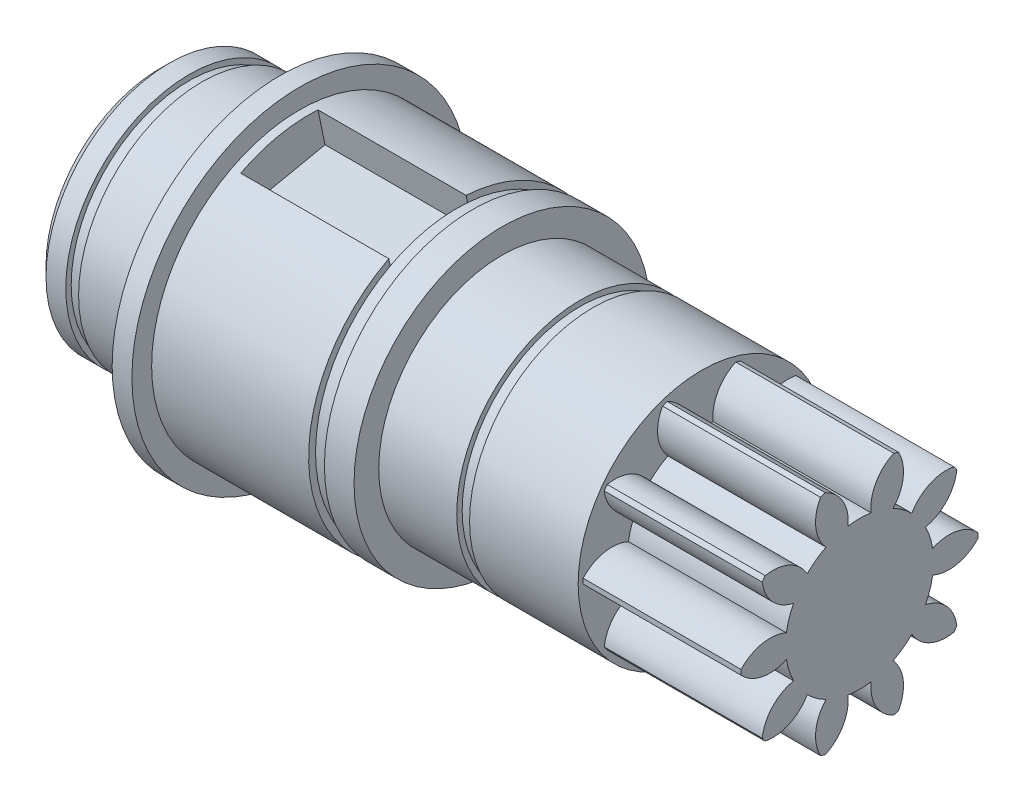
SolidWorks part; units mm, degrees
ref_plane "Plane1" through (0, 0, 0) normal (0, 0, 1) x (1, 0, 0)
ref_plane "Plane2" through (0, 0, 0) normal (0, 1, 0) x (1, 0, 0)
ref_plane "Plane3" through (0, 0, 0) normal (1, 0, 0) x (0, 0, -1)
sketch "HoldingSke" plane through (0, 0, 0) normal (0, 1, 0) x (1, 0, 0)
  line L0 (0, 0) -> (0.4924, -0.0868)
  line L1 (-15, 0) -> (100, 0) construction
  line L2 (0, 0) -> (-2.1039, 2.3779)
  line L3 (0, 0) -> (-11.863, 4.5341)
  line L4 (0, 0) -> (8.5048, 1.4996)
  line L5 (0, 0) -> (-46.8476, -17.4728)
  line L6 (0, 0) -> (-13.2634, -8.9489)
  line L7 (-2.1039, 2.3779) -> (8.6586, 51.2059)
  line L8 (-76.2, 54.61) -> (-73.9, 54.61)
  line L9 (-71.009, 38.7566) -> (-53.1078, 45.2721)
  line L10 (-76.2, 71.12) -> (104.1128, 71.12)
  line L11 (0, 0) -> (-16, 0)
  line L12 (-76.2, 101.6) -> (-76.133, 101.6)
  line L13 (24.9733, 27.94) -> (52.9518, 28.4284)
  line L14 (24.9733, 27.94) -> (24.9743, 27.94)
  line L15 (24.9733, 27.94) -> (100.4006, 29.5858)
  line L16 (-63.627, -2) -> (-12.827, -2)
  circle A0 centre (0, 0) radius 8
  circle A1 centre (0, 0) radius 7.499
  circle A2 centre (0, 0) radius 37.5
  circle A3 centre (0, 0) radius 7.4736
  dimension "MHD" = 14.998
  dimension "Hub_dia" = 75
  dimension "Bore" = 16
  dimension "MBD" = 14.9472
  dimension "Num_teeth" = 10
  dimension "Pitch_radius" = 180.3128
  dimension "Pitch" = 0.5
  dimension "Width" = 16
  dimension "Overall_len" = 50
  dimension "Show_teeth" = 10
  dimension "Thickness" = 16
  dimension "OAL" = 50.0001
  dimension "T_dim" = 2.3
  dimension "Ap" = 20
  dimension "H" = 19.05
  dimension "Backlash" = 0.067
  dimension "Addendum_fac" = 1
  dimension "Dedendum_fac" = 1.25
  dimension "Clearance_fac" = 0.25
  dimension "Dedendum_add" = 0.001
  dimension "Module" = 2
sketch "BasProSke" plane through (0, 0, 0) normal (0, 1, 0) x (1, 0, 0)
  line L0 (-10, 0) -> (60, 0) construction
  line L1 (0, 0) -> (0, 12)
  line L2 (0, 0) -> (16, 0)
  line L3 (16, 0) -> (16, 12)
  line L4 (16, 12) -> (0, 12)
  dimension "Diameter" = 24
  dimension "Thickness" = 16
revolve "Base-Revolve" add sketch "BasProSke" angle 360 about L0
sketch "TooCutSke" plane through (0, 0, 0) normal (1, 0, 0) x (0, 0, -1)
  line L1 (0, 0) -> (0, 107) construction
  line L2 (0, 0) -> (-1.6814, 9.8576) construction
  line L3 (0, 0) -> (-6.1153, 18.8209) construction
  line L4 (-1.6814, 9.8576) -> (-3.0576, 9.4105) construction
  arc A0 (1.1737, 7.4066) -> (-1.1737, 7.4066) centre (0, 0) ccw
  arc A1 (3.4979, 11.5054) -> (-3.4979, 11.5054) centre (0, 0) ccw
  circle A2 centre (0, 0) radius 10 construction
  circle A3 centre (0, 0) radius 9.3969 construction
  arc A4 (-1.1737, 7.4066) -> (-3.4979, 11.5054) centre (-5.1477, 7.8615) ccw
  arc A5 (3.4979, 11.5054) -> (1.1737, 7.4066) centre (5.1477, 7.8615) ccw
  dimension "Root_dia" = 14.998
  dimension "Overcut_dia" = 24.0508
  dimension "Pitch_dia" = 20
  dimension "Base_dia" = 18.7939
  dimension "Flank_rad" = 4
  dimension "Half_ang" = 18
  dimension "Half_CT" = 1.4471
extrude "ToothCut" cut sketch "TooCutSke" along normal through all
fillet "Breaks" radius 0.04
fillet "RootFillets" radius 0.501
pattern_circular "TeethCuts" count 10 every 36 about axis through (-10, 0, 0) along (1, 0, 0) of "ToothCut", "RootFillets", "Breaks"
sketch "HubNeaOneSke" plane through (0, 0, 0) normal (-1, 0, 0) x (0, 0, 1)
  circle A0 centre (0, 0) radius 7.499
  dimension "Diameter" = 14.998
extrude "HubNearOne" add sketch "HubNeaOneSke" along normal blind 34.0001
sketch "HubNeaBotSke" plane through (0, 0, 0) normal (-1, 0, 0) x (0, 0, 1)
  circle A0 centre (0, 0) radius 7.499
  dimension "Diameter" = 14.998
extrude "HubNearBoth" add sketch "HubNeaBotSke" along normal blind 17
ref_plane "FarPln" through (16, 0, 0) normal (1, 0, 0) x (0, 0, -1)
sketch "HubFarSke" plane through (16, 0, 0) normal (1, 0, 0) x (0, 0, -1)
  circle A0 centre (0, 0) radius 7.499
  dimension "Diameter" = 14.998
extrude "HubFar" add sketch "HubFarSke" along normal blind 17
sketch "BorSke" plane through (0, 0, 0) normal (1, 0, 0) x (0, 0, -1)
  circle A0 centre (0, 0) radius 7.4736
  dimension "Diameter" = 14.9472
extrude "Bore" cut sketch "BorSke" along normal mid plane 100.0001
sketch "KeySke" plane through (0, 0, 0) normal (1, 0, 0) x (0, 0, -1)
  line L0 (-2.5, 0) -> (-2.5, 9.7736)
  line L1 (-2.5, 9.7736) -> (2.5, 9.7736)
  line L2 (2.5, 9.7736) -> (2.5, 0)
  line L3 (0, 0) -> (0, 34) construction
  line L4 (-2.5, 0) -> (2.5, 0)
  dimension "Offset" = 9.7736
  dimension "Width" = 5
extrude "Keyway" cut sketch "KeySke" along normal mid plane 100.0001
pattern_circular "Keyway2" count 2 every 90 about axis through (-10, 0, 0) along (1, 0, 0)
sketch "Esquisse1" plane through (16, 0, 0) normal (1, 0, 0) x (0, 0, -1)
  circle A0 centre (0, 0) radius 7.4736
  circle A2 centre (0, 0) radius 7.4736 construction
extrude "Extrusion2" add sketch "Esquisse1" against normal blind 16
sketch "Esquisse2" plane through (0, 0, 0) normal (-1, 0, 0) x (0, 0, 1)
  circle A0 centre (0, 0) radius 12.5
  dimension "D1" = 25
extrude "Extrusion3" add sketch "Esquisse2" along normal blind 11
sketch "Esquisse3" plane through (-11, 0, 0) normal (-1, 0, 0) x (0, 0, 1)
  circle A0 centre (0, 0) radius 11.95
  dimension "D1" = 23.9
extrude "Extrusion4" add sketch "Esquisse3" along normal blind 1.3
sketch "Esquisse4" plane through (-12.3, 0, 0) normal (-1, 0, 0) x (0, 0, 1)
  circle A0 centre (0, 0) radius 12.5
  dimension "D1" = 25
extrude "Extrusion5" add sketch "Esquisse4" along normal blind 7.9
sketch "Esquisse5" plane through (-20.2, 0, 0) normal (-1, 0, 0) x (0, 0, 1)
  circle A0 centre (0, 0) radius 15
  dimension "D1" = 30
extrude "Extrusion6" add sketch "Esquisse5" along normal blind 3
sketch "Esquisse6" plane through (-23.2, 0, 0) normal (-1, 0, 0) x (0, 0, 1)
  circle A0 centre (0, 0) radius 14.3
  dimension "D1" = 28.6
extrude "Extrusion7" add sketch "Esquisse6" along normal blind 1.6
sketch "Esquisse7" plane through (-24.8, 0, 0) normal (-1, 0, 0) x (0, 0, 1)
  circle A0 centre (0, 0) radius 15
  dimension "D1" = 30
extrude "Extrusion8" add sketch "Esquisse7" along normal blind 15.9
sketch "Esquisse8" plane through (-40.7, 0, 0) normal (-1, 0, 0) x (0, 0, 1)
  circle A0 centre (0, 0) radius 17
  dimension "D1" = 34
extrude "Extrusion9" add sketch "Esquisse8" along normal blind 2
sketch "Esquisse9" plane through (-42.7, 0, 0) normal (-1, 0, 0) x (0, 0, 1)
  circle A0 centre (0, 0) radius 12.5
  dimension "D1" = 25
extrude "Extrusion11" add sketch "Esquisse9" along normal blind 7.9
sketch "Esquisse10" plane through (-50.6, 0, 0) normal (-1, 0, 0) x (0, 0, 1)
  circle A0 centre (0, 0) radius 11.95
  dimension "D1" = 23.9
extrude "Extrusion12" add sketch "Esquisse10" along normal blind 1.3
sketch "Esquisse11" plane through (-51.9, 0, 0) normal (-1, 0, 0) x (0, 0, 1)
  circle A0 centre (0, 0) radius 12.5
  dimension "D1" = 25
extrude "Extrusion13" add sketch "Esquisse11" along normal blind 3
chamfer "Chanfrein1" distance 1 angle 45 1 edges at (-54.9, 0, 12.5)
sketch "Esquisse12" plane through (-24.8, 0, 0) normal (1, 0, 0) x (0, 0, -1)
  line L0 (0.2289, 18.3955) -> (1.6658, 11.5446)
  line L1 (0.2289, 18.3955) -> (-7.6007, 16.7534)
  line L2 (-7.6007, 16.7534) -> (-6.1639, 9.9025)
  line L3 (-6.1639, 9.9025) -> (1.6658, 11.5446)
  dimension "D1" = 7
extrude "Enlèv. mat.-Extru.1" cut sketch "Esquisse12" against normal blind 15
equation "' \"Module@HoldingSke\" = 6.35"
equation "' \"Num_teeth@HoldingSke\" = 12"
equation "' \"Ap@HoldingSke\" =  20"
equation "' \"Width@HoldingSke\" = 0.5 * 25.4"
equation "' \"Hub_dia@HoldingSke\"= 1 * 25.4"
equation "' \"Overall_len@HoldingSke\" = 1.0 * 25.4"
equation "' \"Bore@HoldingSke\" = 0.75 * 25.4"
equation "' \"T_dim@HoldingSke\" = 0.1 * 25.4"
equation "' \"Width@KeySke\" = 0.25 * 25.4"
equation "' \"Show_teeth@HoldingSke\" = 13"
equation "' \"Backlash@HoldingSke\" = 0.009 * 25.4"
equation "' \"Addendum_fac@HoldingSke\" = 1.0"
equation "' \"Dedendum_fac@HoldingSke\" = 1.25"
equation "' \"Dedendum_add@HoldingSke\" = 0.00005 * 25.4"
equation "' \"Clearance_fac@HoldingSke\" = 0.25"
equation "\"Pitch@HoldingSke\" = 1 / \"Module@HoldingSke\""
equation "\"Overcut_dia@TooCutSke\" = (\"Num_teeth@HoldingSke\" + 2 * \"Addendum_fac@HoldingSke\") / \"Pitch@HoldingSke\" + 0.002 * 25.4"
equation "\"Pitch_dia@TooCutSke\" = \"Num_teeth@HoldingSke\" / \"Pitch@HoldingSke\""
equation "\"Base_dia@TooCutSke\" = \"Num_teeth@HoldingSke\" / \"Pitch@HoldingSke\" * cos((\"Ap@HoldingSke\"  * 3.14159265 / 180))"
equation "\"Root_dia@TooCutSke\" = (\"Num_teeth@HoldingSke\" + 2) / \"Pitch@HoldingSke\" - 2 * (\"Addendum_fac@HoldingSke\" + \"Dedendum_fac@HoldingSke\") / \"Pitch@HoldingSke\" - \"Dedendum_add@HoldingSke\" * 2"
equation "\"Half_ang@TooCutSke\" = 180 / \"Num_teeth@HoldingSke\""
equation "\"Half_CT@TooCutSke\" = \"Num_teeth@HoldingSke\" / \"Pitch@HoldingSke\" * sin((3.14159265 / 2 / \"Num_teeth@HoldingSke\")) / 2 - 7 * \"Backlash@HoldingSke\" / 4"
equation "\"Flank_rad@TooCutSke\" = \"Num_teeth@HoldingSke\" / \"Pitch@HoldingSke\" / 5"
equation "\"Radius@RootFillets\" = \"Clearance_fac@HoldingSke\" / \"Pitch@HoldingSke\" + \"Dedendum_add@HoldingSke\""
equation "\"Break_rad@Breaks\" = 0.02 / \"Pitch@HoldingSke\""
equation "\"Thickness@HoldingSke\" = \"Width@HoldingSke\""
equation "\"OAL@HoldingSke\" = \"Thickness@HoldingSke\""
equation "\"MHD@HoldingSke\" = (\"Num_teeth@HoldingSke\" + 2) / \"Pitch@HoldingSke\" - 2 * (\"Addendum_fac@HoldingSke\" + \"Dedendum_fac@HoldingSke\")  / \"Pitch@HoldingSke\" - \"Dedendum_add@HoldingSke\" * 2"
equation "\"MBD@HoldingSke\" = (\"Num_teeth@HoldingSke\" + 2) / \"Pitch@HoldingSke\" - 2 * (\"Addendum_fac@HoldingSke\" + \"Dedendum_fac@HoldingSke\")  / \"Pitch@HoldingSke\" - \"Dedendum_add@HoldingSke\" * 2 - 0.002 * 25.4"
equation "\"MHD@HoldingSke\" = ((sgn( \"MHD@HoldingSke\" - \"Hub_dia@HoldingSke\" )-1)*( \"MHD@HoldingSke\" - \"Hub_dia@HoldingSke\" ))/-2+ \"Hub_dia@HoldingSke\""
equation "\"MBD@HoldingSke\" = ((sgn( \"MBD@HoldingSke\" - \"Bore@HoldingSke\" )-1)*( \"MBD@HoldingSke\" - \"Bore@HoldingSke\" ))/-2+ \"Bore@HoldingSke\""
equation "\"OAL@HoldingSke\" = ((sgn( \"OAL@HoldingSke\" - \"Overall_len@HoldingSke\" )+1)*( \"OAL@HoldingSke\" - \"Overall_len@HoldingSke\" ))/2 + \"Overall_len@HoldingSke\" + 0.000002 * 25.4"
equation "\"Num_teeth@TeethCuts\" = int( \"Show_teeth@HoldingSke\" ) + 1"
equation "\"Num_teeth@TeethCuts\" = ((sgn( \"Num_teeth@TeethCuts\" - \"Num_teeth@HoldingSke\" )-1)*( \"Num_teeth@TeethCuts\" - \"Num_teeth@HoldingSke\" ))/-2+ \"Num_teeth@HoldingSke\""
equation "\"Num_teeth@TeethCuts\" = ((sgn( \"Num_teeth@TeethCuts\" - 2.0)+1)*( \"Num_teeth@TeethCuts\" - 2.0))/2 +2.0"
equation "\"Angle@TeethCuts\" = 360.0 / \"Num_teeth@HoldingSke\""
equation "\"Diameter@BasProSke\" = (\"Num_teeth@HoldingSke\" + 2 * \"Addendum_fac@HoldingSke\") / \"Pitch@HoldingSke\""
equation "\"Thickness@BasProSke\"  = \"Thickness@HoldingSke\""
equation "' \"Fillet_rad@BasProSke\" =  \"Thickness@HoldingSke\" * 0.05"
equation "\"MHD@HoldingSke\" = ((sgn( \"MHD@HoldingSke\" - \"Root_dia@TooCutSke\" )-1)*( \"MHD@HoldingSke\" - \"Root_dia@TooCutSke\" ))/-2+ \"Root_dia@TooCutSke\""
equation "\"Diameter@HubNeaOneSke\" = \"MHD@HoldingSke\""
equation "\"Length@HubNearOne\" = \"OAL@HoldingSke\" - \"Thickness@BasProSke\""
equation "\"Diameter@HubNeaBotSke\" = \"MHD@HoldingSke\""
equation "\"Length@HubNearBoth\" = ( \"OAL@HoldingSke\" - \"Thickness@BasProSke\" ) / 2.0"
equation "\"Thickness@FarPln\" = \"Thickness@BasProSke\""
equation "\"Diameter@HubFarSke\" = \"MHD@HoldingSke\""
equation "\"Length@HubFar\" = ( \"OAL@HoldingSke\" - \"Thickness@BasProSke\" ) / 2.0"
equation "\"Diameter@BorSke\" = \"MBD@HoldingSke\""
equation "\"D1@Bore\" = \"OAL@HoldingSke\" * 2.0"
equation "\"D1@Keyway\" = \"OAL@HoldingSke\" * 2.0"
equation "\"Offset@KeySke\" = \"T_dim@HoldingSke\" + \"MBD@HoldingSke\" / 2.0"
